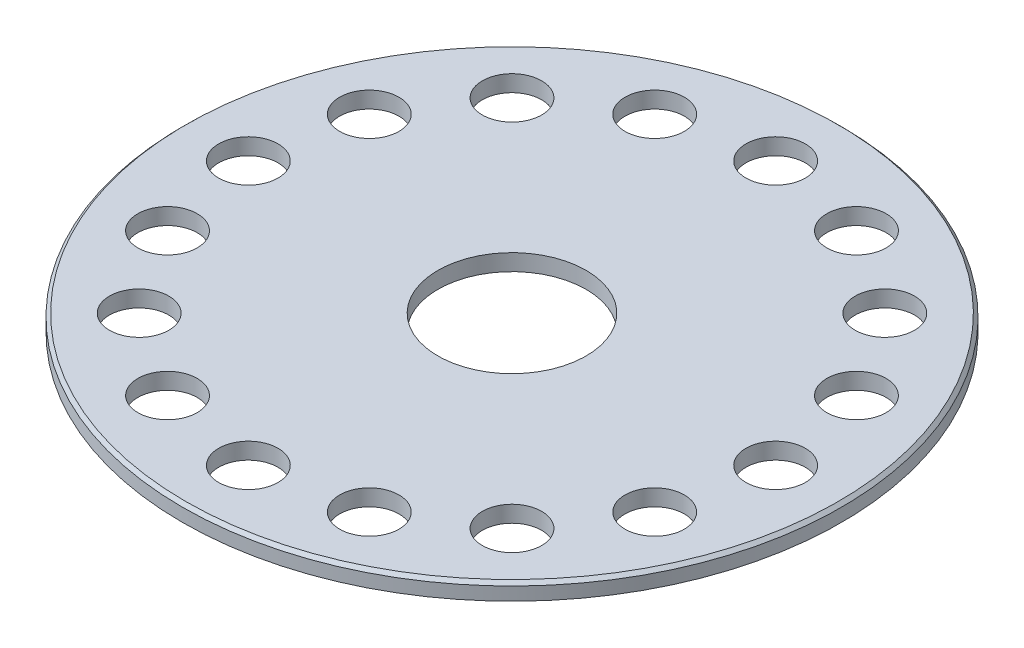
SolidWorks part; units mm, degrees
ref_plane "Front Plane" through (0, 0, 0) normal (0, 0, 1) x (1, 0, 0)
ref_plane "Top Plane" through (0, 0, 0) normal (0, 1, 0) x (1, 0, 0)
ref_plane "Right Plane" through (0, 0, 0) normal (1, 0, 0) x (0, 0, -1)
sketch "Sketch1" plane through (0, 0, 0) normal (0, 1, 0) x (1, 0, 0)
  circle A0 centre (0, 0) radius 100
  dimension "D1" = 200
extrude "Boss-Extrude1" add sketch "Sketch1" along normal blind 5
sketch "Sketch2" plane through (0, 5, 0) normal (0, 1, 0) x (1, 0, 0)
  line L0 (0, 80) -> (0, 0) construction
  circle A0 centre (0, 80) radius 9
  dimension "D1" = 18
  dimension "D2" = 80
extrude "Cut-Extrude1" cut sketch "Sketch2" against normal through all
pattern_circular "CirPattern1" count 16 over 360 about axis through (0, 0, 0) along (0, 1, 0) of "Cut-Extrude1"
sketch "Sketch4" plane through (0, 0, 0) normal (0, -1, 0) x (-1, 0, 0)
  circle A0 centre (0, 0) radius 22.5
  circle A1 centre (0, 0) radius 100 construction
  dimension "D1" = 45
extrude "Cut-Extrude3" cut sketch "Sketch4" against normal through all
chamfer "Chamfer1" distance 1 angle 45 1 edges at (0, 5, 100)
